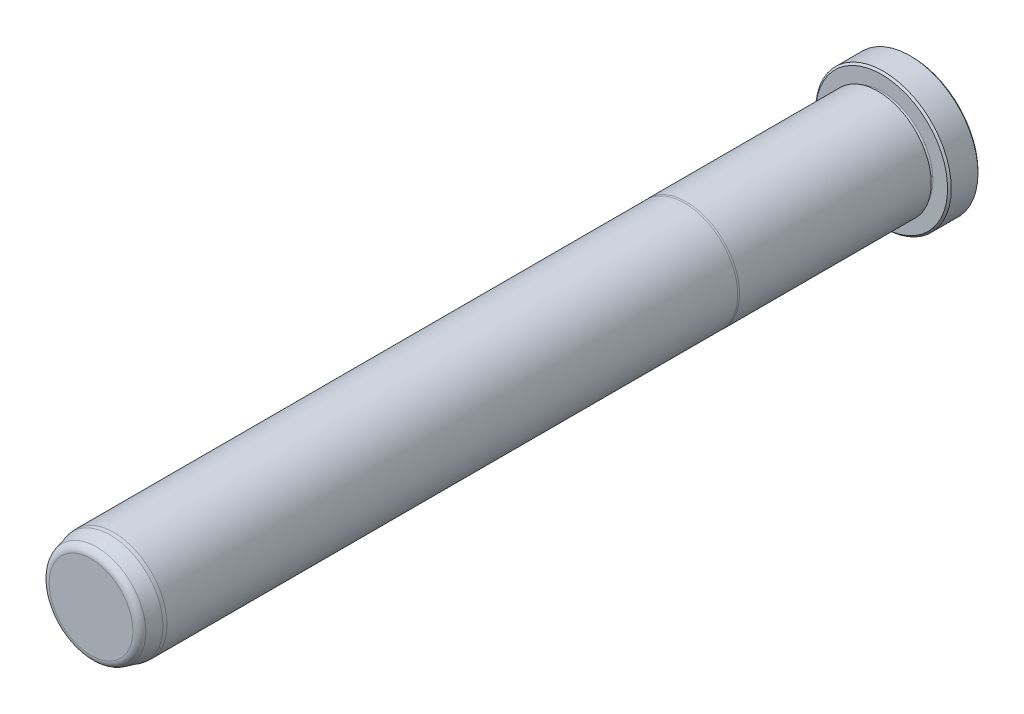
SolidWorks part; units mm, degrees
ref_plane "Front Plane" through (0, 0, 0) normal (0, 0, 1) x (1, 0, 0)
ref_plane "Top Plane" through (0, 0, 0) normal (0, 1, 0) x (1, 0, 0)
ref_plane "Right Plane" through (0, 0, 0) normal (1, 0, 0) x (0, 0, -1)
sketch "Sketch1" plane through (0, 0, 0) normal (1, 0, 0) x (0, 0, -1)
  line L0 (0, 0) -> (0, 14.1605)
  line L1 (0, 14.1605) -> (-6.35, 14.1605)
  line L2 (-6.35, 14.1605) -> (-6.35, 10.7188)
  line L3 (-6.35, 10.3378) -> (-7.112, 10.3378) construction
  line L4 (-7.112, 10.7188) -> (-7.112, 11.1252)
  line L5 (-7.112, 11.1252) -> (-47.1348, 11.1252)
  line L6 (-47.1348, 11.1252) -> (-47.498, 11.0998)
  line L7 (-47.498, 11.0998) -> (-166.6875, 11.0998)
  line L9 (-171.45, 9.9612) -> (-171.45, 0)
  line L10 (-171.45, 0) -> (0, 0)
  line L11 (0, 0) -> (13.6287, 0) construction
  line L12 (-166.6875, 11.0998) -> (-167.4495, 11.0331)
  line L13 (-167.4495, 11.0331) -> (-171.45, 9.9612)
  arc A0 (-7.112, 10.7188) -> (-6.35, 10.7188) centre (-6.731, 10.7188) ccw
  dimension "D14" = 0.762
  dimension "D1" = 6.35
  dimension "D2" = 0.762
  dimension "D3" = 28.321
  dimension "D4" = 22.2504
  dimension "D5" = 47.498
  dimension "D6" = 171.45
  dimension "D7" = 0.7874
  dimension "D8" = 4
  dimension "D9" = 22.1996
  dimension "D10" = 5
  dimension "D11" = 15
  dimension "D12" = 0.762
  dimension "D13" = 4.7625
revolve "Revolve1" add sketch "Sketch1" angle 360 about L11
fillet "Fillet6" radius 1.5875 1 edges at (9.9612, 0, 171.45)
chamfer "Chamfer1" distance 0.381 angle 45 2 edges at (14.1605, 0, 0) (14.1605, 0, 6.35)
